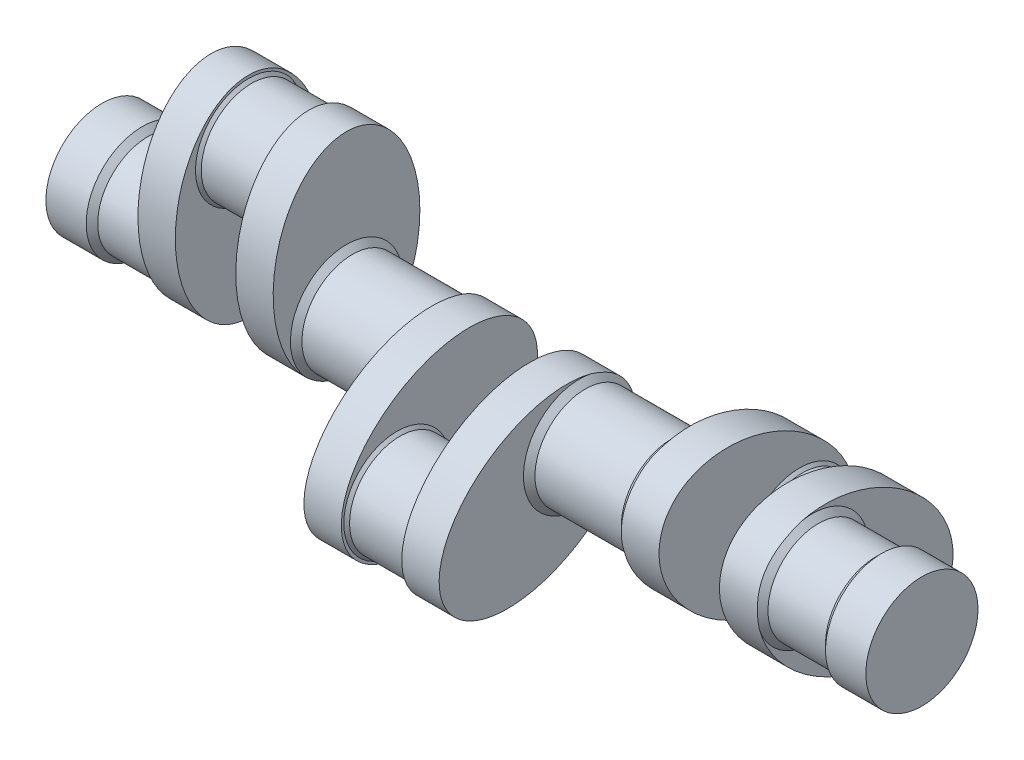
SolidWorks part; units mm, degrees
ref_plane "Front Plane" through (0, 0, 0) normal (0, 0, 1) x (1, 0, 0)
ref_plane "Top Plane" through (0, 0, 0) normal (0, 1, 0) x (1, 0, 0)
ref_plane "Right Plane" through (0, 0, 0) normal (1, 0, 0) x (0, 0, -1)
sketch "Sketch2" plane through (0, 0, 0) normal (1, 0, 0) x (0, 0, -1)
  circle A0 centre (0, 0) radius 19.5
  dimension "D1" = 39
extrude "Boss-Extrude1" add sketch "Sketch2" along normal blind 14
sketch "Sketch3" plane through (14, 0, 0) normal (1, 0, 0) x (0, 0, -1)
  circle A0 centre (0, 0) radius 17.5
  dimension "D1" = 35
extrude "Boss-Extrude2" add sketch "Sketch3" along normal blind 24
sketch "Sketch4" plane through (38, 0, 0) normal (1, 0, 0) x (0, 0, -1)
  line L0 (0, -19.5) -> (0, 19.0704) construction
  line L1 (0, -19.5) -> (0, 17) construction
  line L2 (0, 17) -> (0, 53.5) construction
  line L3 (0, 0) -> (0, -19.5) construction
  circle A0 centre (0, 17) radius 36.5 construction
  circle A1 centre (0, 17) radius 25.5 construction
  circle A2 centre (0, 0) radius 19.5 construction
  ellipse E0 centre (0, 17) end of major axis (0, -19.5) minor radius 25.5
  point P17 (0, 0)
  dimension "D2" = 73
  dimension "D3" = 51
  dimension "D1" = 0
extrude "Boss-Extrude3" add sketch "Sketch4" along normal blind 13
sketch "Sketch5" plane through (51, 0, 0) normal (1, 0, 0) x (0, 0, -1)
  line L0 (0, 0) -> (0, 34) construction
  circle A0 centre (0, 34) radius 17.5
  dimension "D1" = 35
  dimension "D2" = 34
extrude "Boss-Extrude4" add sketch "Sketch5" along normal blind 21
sketch "Sketch6" plane through (72, 0, 0) normal (1, 0, 0) x (0, 0, -1)
  line L0 (0, 53.5) -> (0, 65.6891) construction
  line L1 (0, 53.5) -> (0, 17) construction
  line L2 (0, 17) -> (0, -19.5) construction
  line L3 (0, 34) -> (0, 53.5) construction
  circle A0 centre (0, 17) radius 36.5 construction
  circle A1 centre (0, 17) radius 25.5 construction
  ellipse E0 centre (0, 17) end of major axis (0, 53.5) minor radius 25.5
  ellipse E1 centre (0, 17) end of major axis (0, -19.5) minor radius 25.5 construction
  point P20 (0, 0)
  dimension "D2" = 73
  dimension "D3" = 51
  dimension "D1" = 180
extrude "Boss-Extrude5" add sketch "Sketch6" along normal blind 13
sketch "Sketch7" plane through (85, 0, 0) normal (1, 0, 0) x (0, 0, -1)
  line L0 (0, -19.5) -> (0, 0) construction
  circle A1 centre (0, 0) radius 17.5
  ellipse E0 centre (0, 17) end of major axis (0, 53.5) minor radius 25.5 construction
  point P2 (0, 0)
  point P3 (0, -19.5)
  point P13 (0, 0.7851)
  dimension "D1" = 19.5
  dimension "D2" = 35
extrude "Boss-Extrude6" add sketch "Sketch7" along normal blind 34
sketch "Sketch8" plane through (119, 0, 0) normal (1, 0, 0) x (0, 0, -1)
  line L0 (16.8875, 9.75) -> (16.8875, 50.7615) construction
  line L1 (16.8875, 9.75) -> (-14.7224, -8.5) construction
  line L2 (-14.7224, -8.5) -> (-46.3324, -26.75) construction
  line L3 (0, 0) -> (9.4239, 0) construction
  line L4 (0, 0) -> (16.8875, 9.75) construction
  circle A0 centre (-14.7224, -8.5) radius 36.5 construction
  circle A1 centre (-14.7224, -8.5) radius 25.5 construction
  circle A2 centre (0, 0) radius 19.5 construction
  ellipse E0 centre (-14.7224, -8.5) end of major axis (16.8875, 9.75) minor radius 25.5
  point P11 (16.8875, 9.75)
  point P17 (0, 0)
  dimension "D2" = 73
  dimension "D3" = 51
  dimension "D4" = 39
  dimension "D1" = 120
  dimension "D5" = 30
extrude "Boss-Extrude7" add sketch "Sketch8" along normal blind 13
sketch "Sketch9" plane through (132, 0, 0) normal (1, 0, 0) x (0, 0, -1)
  line L0 (0, 0) -> (0, 8.9725) construction
  line L2 (0, 0) -> (-29.4449, -17) construction
  circle A0 centre (-29.4449, -17) radius 17.5
  dimension "D1" = 35
  dimension "D2" = 120
  dimension "D3" = 34
extrude "Boss-Extrude8" add sketch "Sketch9" along normal blind 21
sketch "Sketch10" plane through (153, 0, 0) normal (1, 0, 0) x (0, 0, -1)
  line L0 (16.8875, 9.75) -> (16.8875, 23.5299) construction
  line L1 (16.8875, 9.75) -> (-14.7224, -8.5) construction
  line L2 (-14.7224, -8.5) -> (-46.3324, -26.75) construction
  line L3 (-29.4449, -17) -> (-29.4449, -7.5463) construction
  line L4 (-29.4449, -17) -> (-46.3324, -26.75) construction
  circle A0 centre (-14.7224, -8.5) radius 36.5 construction
  circle A1 centre (-14.7224, -8.5) radius 25.5 construction
  ellipse E0 centre (-14.7224, -8.5) end of major axis (-46.3324, -26.75) minor radius 25.5
  ellipse E1 centre (-14.7224, -8.5) end of major axis (16.8875, 9.75) minor radius 25.5 construction
  point P14 (-46.3324, -26.75)
  point P22 (0, 0)
  dimension "D2" = 73
  dimension "D3" = 51
  dimension "D1" = 120
  dimension "D4" = 120
extrude "Boss-Extrude9" add sketch "Sketch10" along normal blind 13
sketch "Sketch11" plane through (166, 0, 0) normal (1, 0, 0) x (0, 0, -1)
  circle A0 centre (0, 0) radius 17.5
  point P0 (0, 0)
  point P2 (0, 0)
  point P12 (0, 0)
  point P13 (-3.7817, 4.5915)
  dimension "D1" = 35
extrude "Boss-Extrude10" add sketch "Sketch11" along normal blind 34
sketch "Sketch12" plane through (200, 0, 0) normal (1, 0, 0) x (0, 0, -1)
  line L0 (-16.8875, 9.75) -> (-16.8875, 23.5299) construction
  line L1 (-16.8875, 9.75) -> (14.7224, -8.5) construction
  line L2 (14.7224, -8.5) -> (46.3324, -26.75) construction
  line L3 (0, 0) -> (0, 12.2269) construction
  line L4 (0, 0) -> (24.7297, -14.2777) construction
  line L5 (0, 0) -> (-16.8875, 9.75) construction
  circle A0 centre (14.7224, -8.5) radius 36.5 construction
  circle A1 centre (14.7224, -8.5) radius 25.5 construction
  circle A2 centre (0, 0) radius 19.5 construction
  ellipse E0 centre (14.7224, -8.5) end of major axis (-16.8875, 9.75) minor radius 25.5
  point P16 (0, 0)
  dimension "D2" = 73
  dimension "D3" = 51
  dimension "D5" = 39
  dimension "D1" = 240
  dimension "D4" = 120
extrude "Boss-Extrude11" add sketch "Sketch12" along normal blind 13
sketch "Sketch13" plane through (213, 0, 0) normal (1, 0, 0) x (0, 0, -1)
  line L0 (0, 0) -> (29.4449, -17) construction
  line L1 (0, 0) -> (0, 7.7619) construction
  circle A0 centre (29.4449, -17) radius 17.5
  dimension "D3" = 35
  dimension "D1" = 34
  dimension "D2" = 120
extrude "Boss-Extrude12" add sketch "Sketch13" along normal blind 21
sketch "Sketch14" plane through (234, 0, 0) normal (1, 0, 0) x (0, 0, -1)
  line L0 (-16.8875, 9.75) -> (-16.8875, 23.5299) construction
  line L1 (-16.8875, 9.75) -> (14.7224, -8.5) construction
  line L2 (14.7224, -8.5) -> (46.3324, -26.75) construction
  line L3 (29.4449, -17) -> (46.3324, -26.75) construction
  line L4 (29.4449, -17) -> (29.4449, -8.3145) construction
  circle A0 centre (14.7224, -8.5) radius 36.5 construction
  circle A1 centre (14.7224, -8.5) radius 25.5 construction
  ellipse E0 centre (14.7224, -8.5) end of major axis (-16.8875, 9.75) minor radius 25.5
  ellipse E1 centre (14.7224, -8.5) end of major axis (-16.8875, 9.75) minor radius 25.5 construction
  point P14 (46.3324, -26.75)
  point P22 (0, 0)
  dimension "D2" = 73
  dimension "D3" = 51
  dimension "D1" = 240
  dimension "D4" = 120
extrude "Boss-Extrude13" add sketch "Sketch14" along normal blind 13
sketch "Sketch15" plane through (247, 0, 0) normal (1, 0, 0) x (0, 0, -1)
  circle A0 centre (0, 0) radius 17.5
  point P2 (0, 0)
  dimension "D1" = 35
extrude "Boss-Extrude14" add sketch "Sketch15" along normal blind 24
sketch "Sketch16" plane through (271, 0, 0) normal (1, 0, 0) x (0, 0, -1)
  circle A0 centre (0, 0) radius 19.5
  dimension "D1" = 39
extrude "Boss-Extrude15" add sketch "Sketch16" along normal blind 14
chamfer "Chamfer1" distance 2 angle 45 8 edges at (271, 0, -17.5) (247, 0, -17.5) (200, 0, -17.5) (166, 0, -17.5) (119, 0, -17.5) (85, 0, -17.5) (38, 0, -17.5) (14, 0, -17.5)
chamfer "Chamfer2" distance 1 angle 45 6 edges at (234, -17, -46.9449) (213, -17, -46.9449) (132, -17, 11.9449) (153, -17, 11.9449) (72, 34, -17.5) (51, 34, -17.5)
